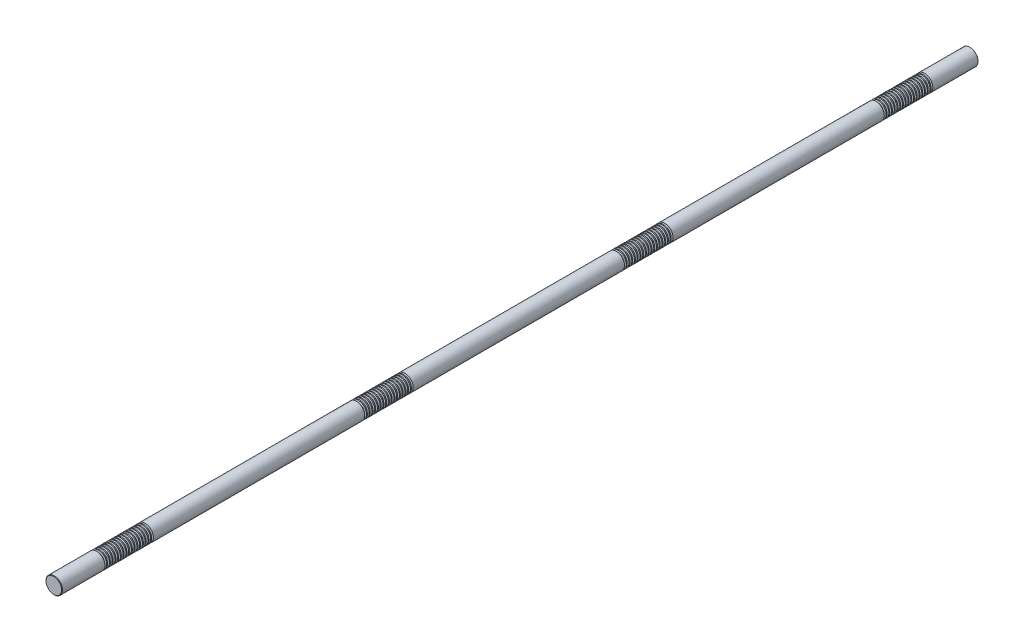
SolidWorks part; units mm, degrees
ref_plane "Front Plane" through (0, 0, 0) normal (0, 0, 1) x (1, 0, 0)
ref_plane "Top Plane" through (0, 0, 0) normal (0, 1, 0) x (1, 0, 0)
ref_plane "Right Plane" through (0, 0, 0) normal (1, 0, 0) x (0, 0, -1)
sketch "Sketch1" plane through (0, 0, 0) normal (0, 0, 1) x (1, 0, 0)
  circle A0 centre (0, 0) radius 18
  dimension "D1" = 36
extrude "Boss-Extrude1" add sketch "Sketch1" along normal mid plane 2000
chamfer "Chamfer1" distance 0.9 angle 45 2 edges at (18, 0, -1000) (18, 0, 1000)
sketch "Sketch2" plane through (0, 0, 0) normal (1, 0, 0) x (0, 0, -1)
  line L0 (900.4689, 18) -> (896.5311, 18)
  line L1 (999.1, 18) -> (-999.1, 18) construction
  line L2 (896.5311, 18) -> (897.4689, 14.5)
  line L3 (897.4689, 14.5) -> (899.5311, 14.5)
  line L4 (899.5311, 14.5) -> (900.4689, 18)
  line L5 (1000, -17.1) -> (1000, 17.1) construction
  point P4 (898.5, 18)
  point P7 (898.5, 14.5)
  point P8 (900, 16.25)
  point P9 (897, 16.25)
  dimension "D1" = 3
  dimension "D2" = 100
  dimension "D3" = 3.5
  dimension "D4" = 30
revolve "Cut-Revolve1" cut sketch "Sketch2" angle 360 about axis through (0, 0, 1000) along (0, 0, -1)
pattern_linear "LPattern1" count 18 spacing 6 along (0, 0, 1) of "Cut-Revolve1"
pattern_linear "LPattern2" count 4 spacing 567 along (0, 0, 1) of "Cut-Revolve1", "LPattern1"
